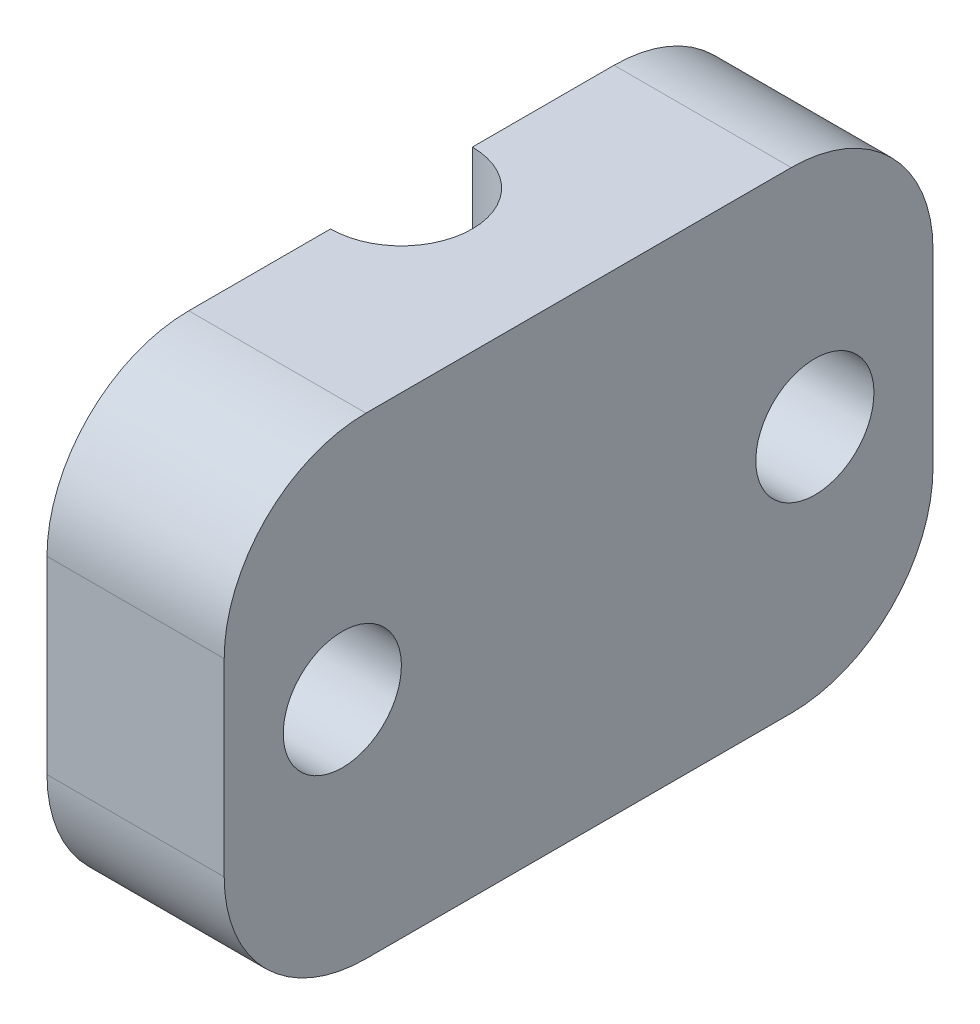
SolidWorks part; units mm, degrees
ref_plane "Front Plane" through (0, 0, 0) normal (0, 0, 1) x (1, 0, 0)
ref_plane "Top Plane" through (0, 0, 0) normal (0, 1, 0) x (1, 0, 0)
ref_plane "Right Plane" through (0, 0, 0) normal (1, 0, 0) x (0, 0, -1)
sketch "Sketch3" plane through (0, 0, 0) normal (0, 0, 1) x (1, 0, 0)
  line L1 (0, 0) -> (-15, 0)
  line L2 (0, 0) -> (0, 20)
  line L3 (0, 20) -> (-15, 20)
  line L4 (-15, 0) -> (-15, 20)
  line L5 (0, 0) -> (-15, 20) construction
  line L6 (0, 20) -> (-15, 0) construction
  point P4 (-7.5, 10)
  dimension "D1" = 15
  dimension "D2" = 20
extrude "Boss-Extrude1" add sketch "Sketch3" along normal blind 30
sketch "Sketch4" plane through (0, 20, 0) normal (0, 1, 0) x (1, 0, 0)
  line L0 (-15, 0) -> (0, -30) construction
  line L1 (-15, -30) -> (0, 0) construction
  circle A0 centre (-7.5, -15) radius 3
  dimension "D1" = 6
extrude "Cut-Extrude1" cut sketch "Sketch4" against normal blind 10 from surface at 0
sketch "Sketch5" plane through (0, 0, 0) normal (0, -1, 0) x (1, 0, 0)
  line L0 (-15, 30) -> (0, 0) construction
  line L1 (-15, 0) -> (0, 30) construction
  circle A0 centre (-7.5, 15) radius 4
  point P13 (-7.5, 15)
  dimension "D1" = 8
extrude "Cut-Extrude2" cut sketch "Sketch5" against normal offset from surface (12 mm away) 8 from surface at 0
fillet "Fillet1" radius 6 4 edges at (-7.5, 0, 30) (-7.5, 20, 30) (-7.5, 20, 0) (-7.5, 0, 0)
sketch "Sketch9" plane through (-15, 0, 0) normal (-1, 0, 0) x (0, 0, 1)
  line L1 (-3.7469, 46.5945) -> (35.7817, 46.5945)
  line L2 (-3.7469, 46.5945) -> (-3.7469, -5.4804)
  line L3 (-3.7469, -5.4804) -> (35.7817, -5.4804)
  line L4 (35.7817, 46.5945) -> (35.7817, -5.4804)
  line L5 (-3.7469, 46.5945) -> (35.7817, -5.4804) construction
  line L6 (-3.7469, -5.4804) -> (35.7817, 46.5945) construction
  point P4 (16.0174, 20.5571)
extrude "Cut-Extrude4" cut sketch "Sketch9" against normal blind 7.5
sketch "Sketch10" plane through (-7.5, 0, 0) normal (-1, 0, 0) x (0, 0, 1)
  line L0 (30, 14) -> (30, 6) construction
  line L1 (0, 14) -> (0, 6) construction
  line L2 (6, 0) -> (11, 0) construction
  line L3 (19, 0) -> (24, 0) construction
  circle A0 centre (25, 10) radius 2.5
  circle A1 centre (5, 10) radius 2.5
  dimension "D1" = 5
  dimension "D2" = 5
  dimension "D3" = 5
  dimension "D4" = 5
  dimension "D5" = 10
  dimension "D6" = 10
extrude "Cut-Extrude5" cut sketch "Sketch10" against normal through all
